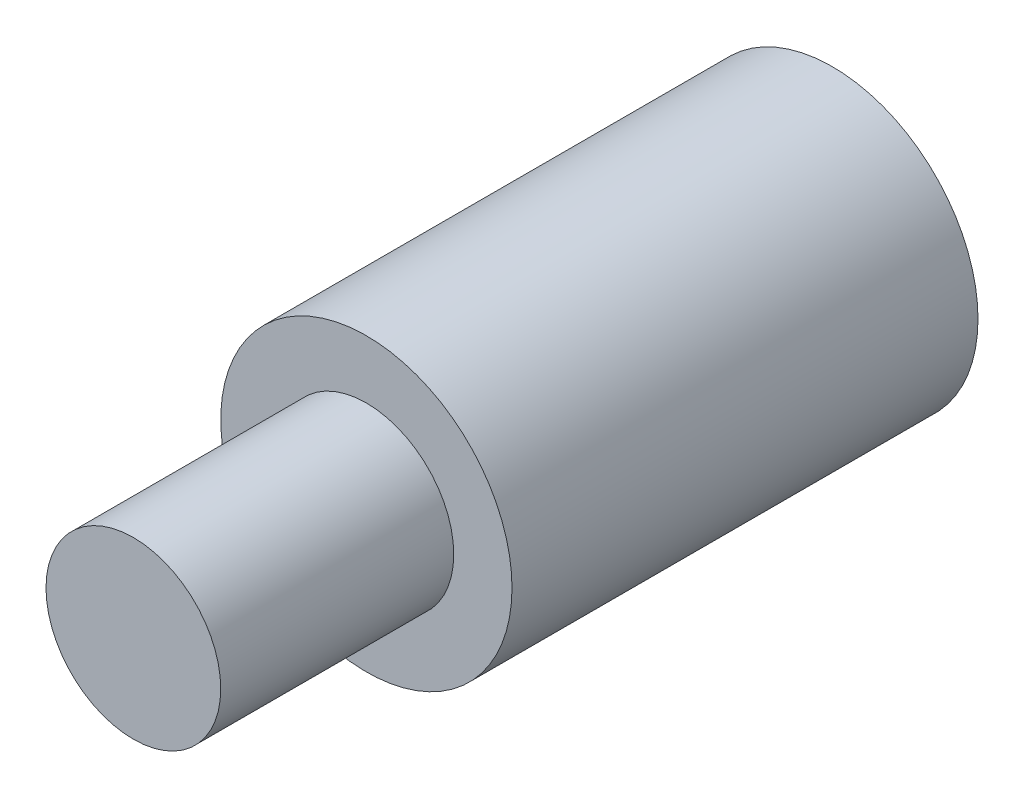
SolidWorks part; units mm, degrees
ref_plane "Face" through (0, 0, 0) normal (0, 0, 1) x (1, 0, 0)
ref_plane "Dessus" through (0, 0, 0) normal (0, 1, 0) x (1, 0, 0)
ref_plane "Droite" through (0, 0, 0) normal (1, 0, 0) x (0, 0, -1)
sketch "Esquisse1" plane through (0, 0, 0) normal (0, 0, 1) x (1, 0, 0)
  circle A0 centre (0, 0) radius 2.5
  dimension "D1" = 5
extrude "Extrusion1" add sketch "Esquisse1" along normal blind 8
sketch "Esquisse2" plane through (0, 0, 8) normal (0, 0, 1) x (1, 0, 0)
  circle A0 centre (0, 0) radius 1.5
  dimension "D1" = 3
extrude "Extrusion2" add sketch "Esquisse2" along normal blind 4
hole_wizard "Trou taraudé M3x0.51" positions "Esquisse5" profile "Esquisse4" tap size "M3x0.5" standard "ISO"
sketch "Esquisse5" plane through (0, 0, 0) normal (0, 0, -1) x (-1, 0, 0)
  circle A0 centre (0, 0) radius 2.5 construction
  point P0 (0, 0)
sketch "Esquisse4" plane through (0, 0, 0) normal (1, 0, 0) x (0, 1, 0)
  line L0 (0, 0) -> (0, 8.2511)
  line L1 (0, 8.2511) -> (1.25, 7.5)
  line L2 (1.25, 7.5) -> (1.25, 0)
  line L5 (1.25, 0) -> (0, 0)
  line L10 (0, 8.2511) -> (-1.25, 7.5) construction
  line L11 (0, -6.35) -> (0, 107.95) construction
  dimension "Diamètre du trou pour taraudage" = 2.5
  dimension "Profondeur du trou pour taraudage" = 7.5
  dimension "Angle de pointe" = 118
